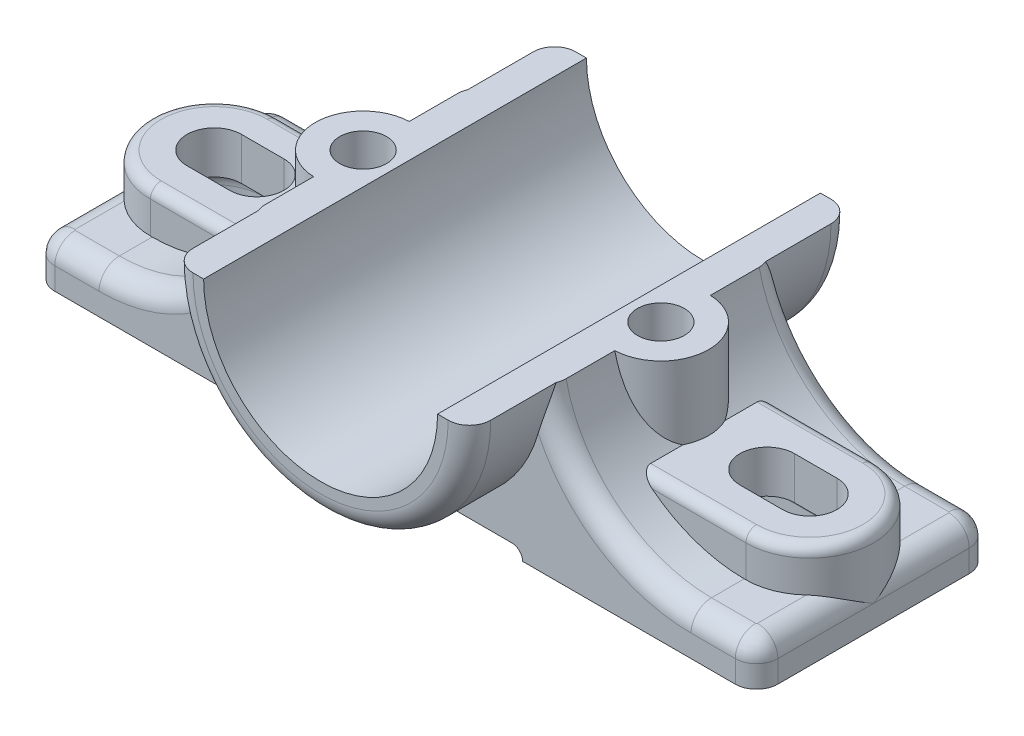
SolidWorks part; units mm, degrees
ref_plane "XY" through (0, 0, 0) normal (0, 0, 1) x (1, 0, 0)
ref_plane "YZ" through (0, 0, 0) normal (0, 1, 0) x (1, 0, 0)
ref_plane "XZ" through (0, 0, 0) normal (1, 0, 0) x (0, 0, -1)
imported_body "Imported1"
hole_wizard "Ø14.0 (14) Diameter Hole1" positions "Sketch2" profile "Sketch3" hole size "Ø14.0" standard "Ansi Metric"
sketch "Sketch2" plane through (0, -21.4217, 0) normal (0, 1, 0) x (-1, 0, 0)
  point P0 (-43.1066, -5.8431)
  point P4 (45.7934, -5.8431)
sketch "Sketch3" plane through (43.1066, -21.4217, -5.8431) normal (1, 0, 0) x (0, 0, 1)
  line L0 (0, 0) -> (0, 47.625)
  line L1 (0, 47.625) -> (7, 47.625)
  line L2 (7, 47.625) -> (7, 0)
  line L5 (7, 0) -> (0, 0)
  line L11 (0, -6.35) -> (0, 107.95) construction
  dimension "Thru Hole Dia." = 14
  dimension "Thru Hole Depth" = 47.625
